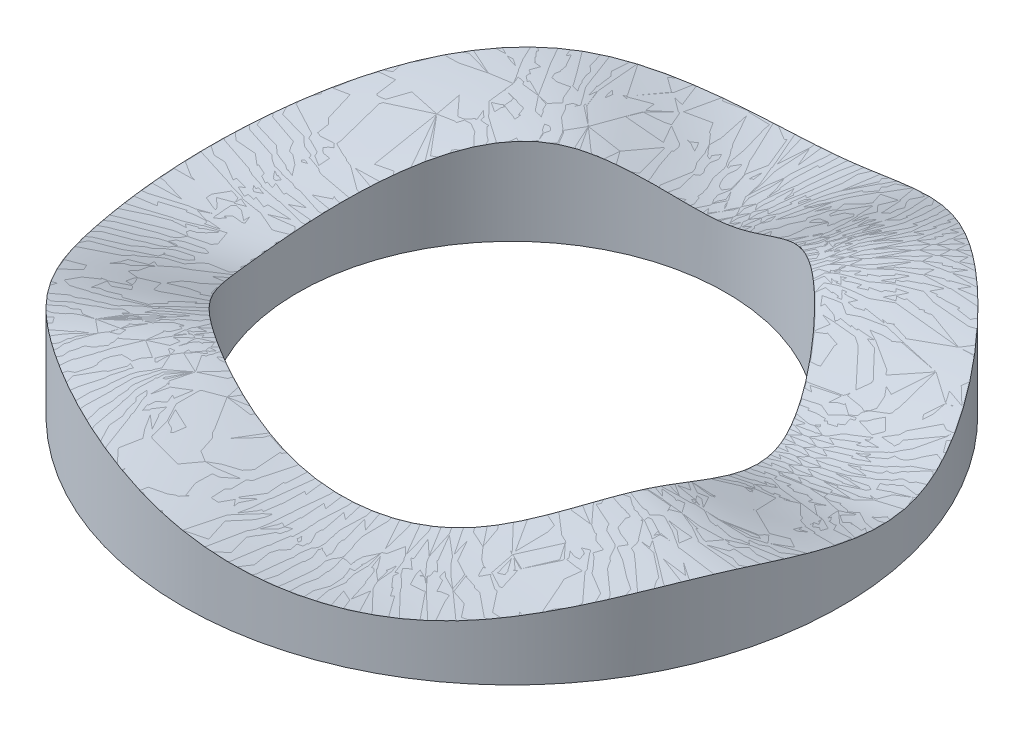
SolidWorks part; units mm, degrees
ref_plane "Ebene vorne" through (0, 0, 0) normal (0, 0, 1) x (1, 0, 0)
ref_plane "Ebene oben" through (0, 0, 0) normal (0, 1, 0) x (1, 0, 0)
ref_plane "Ebene rechts" through (0, 0, 0) normal (1, 0, 0) x (0, 0, -1)
sketch "Skizze1" plane through (0, 0, 0) normal (0, 1, 0) x (1, 0, 0)
  circle A0 centre (0, 0) radius 50
  circle A1 centre (0, 0) radius 32.5
  dimension "D1" = 100
  dimension "D2" = 65
extrude "Linear austragen1" add sketch "Skizze1" along normal blind 20
sketch "Skizze2" plane through (0, 20, 0) normal (0, 1, 0) x (1, 0, 0)
  line L0 (0, 0) -> (0, -50) construction
  line L1 (0, 0) -> (-29.3893, -40.4508) construction
  line L2 (0, 0) -> (-47.5528, -15.4508) construction
  line L3 (0, 0) -> (-47.5528, 15.4508) construction
  line L4 (0, 0) -> (-29.3893, 40.4508) construction
  line L5 (0, 0) -> (0, 50) construction
  line L6 (0, 0) -> (29.3893, 40.4508) construction
  line L7 (0, 0) -> (47.5528, 15.4508) construction
  line L8 (0, 0) -> (47.5528, -15.4508) construction
  line L9 (0, 0) -> (29.3893, -40.4508) construction
  circle A0 centre (0, 0) radius 50 construction
sketch3d "3D-Skizze1"
  spline S0 degree 3 poles (-31.4452, 18.6778, 43.0757) (-0.2043, 8.8385, 53.4326) (31.4376, 6.1421, 43.1658) (50.853, 14.6306, 16.5023) (50.5619, 1.1765, -17.1112) (31.5931, 22.8305, -42.9231) (0.2976, 3.7946, -53.4524) (-31.3557, 16.1997, -43.2221) (-50.7913, 9.3238, -16.6139) (-50.6782, 6.5436, 16.8503) (-31.4452, 18.6778, 43.0757) (-0.2043, 8.8385, 53.4326) (31.4376, 6.1421, 43.1658) knots -0.29941 -0.200615 -0.100028 0 0.09895 0.198157 0.297725 0.40057 0.501816 0.601383 0.70059 0.799385 0.899972 1 1.09895 1.198157 1.297725 only from (0, 10, 50) to (0, 10, 50)
  point P0 (0, 10, 50)
  point P1 (29.3893, 8, 40.4508)
  point P2 (47.5528, 11, 15.4508)
  point P5 (47.5528, 7, -15.4508)
  point P6 (29.3893, 16, -40.4508)
  point P7 (0, 9, -50)
  point P8 (-29.3893, 13, -40.4508)
  point P9 (-47.5528, 10, -15.4508)
  point P10 (-47.5528, 9, 15.4508)
  point P11 (-29.3893, 15, 40.4508)
  dimension "D1" = 10
  dimension "D2" = 15
  dimension "D3" = 8
  dimension "D4" = 11
  dimension "D5" = 7
  dimension "D6" = 16
  dimension "D7" = 9
  dimension "D8" = 13
  dimension "D9" = 10
  dimension "D10" = 9
sketch3d "3D-Skizze2"
  line L1 (0, 20, 0) -> (-29.3893, 20, -40.4508) construction
  line L2 (-19.103, 20, -26.2931) -> (-19.103, 0, -26.2931) construction
  line L3 (0, 20, -32.5) -> (0, 0, -32.5) construction
  line L4 (0, 20, 0) -> (0, 20, -50) construction
  line L6 (19.103, 20, -26.2931) -> (19.103, 0, -26.2931) construction
  line L7 (0, 20, 0) -> (29.3893, 20, -40.4508) construction
  line L10 (30.9093, 20, -10.0431) -> (30.9093, 0, -10.0431) construction
  line L11 (0, 20, 0) -> (47.5528, 20, -15.4508) construction
  line L12 (30.9093, 20, 10.0431) -> (30.9093, 0, 10.0431) construction
  line L13 (0, 20, 0) -> (47.5528, 20, 15.4508) construction
  line L14 (19.103, 20, 26.2931) -> (19.103, 0, 26.2931) construction
  line L15 (0, 20, 0) -> (29.3893, 20, 40.4508) construction
  line L16 (0, 20, 32.5) -> (0, 0, 32.5) construction
  line L17 (0, 20, 0) -> (0, 20, 50) construction
  line L18 (-19.103, 20, 26.2931) -> (-19.103, 0, 26.2931) construction
  line L19 (0, 20, 0) -> (-29.3893, 20, 40.4508) construction
  line L20 (-30.9093, 20, 10.0431) -> (-30.9093, 0, 10.0431) construction
  line L21 (0, 20, 0) -> (-47.5528, 20, 15.4508) construction
  line L22 (-30.9093, 20, -10.0431) -> (-30.9093, 0, -10.0431) construction
  line L23 (0, 20, 0) -> (-47.5528, 20, -15.4508) construction
  circle A0 centre (0, 20, 0) radius 32.5 construction
  circle A1 centre (0, 0, 0) radius 32.5 construction
  spline S0 degree 3 poles (-33.0182, 9.3339, -10.8954) (-20.352, 16.1576, -28.1137) (0.44, 3.8495, -34.7837) (20.6899, 22.8978, -27.6816) (32.6928, 1.2209, -11.6079) (33.1049, 14.5673, 10.7184) (20.4799, 6.1573, 28.0297) (-0.309, 8.8902, 34.7587) (-20.4853, 18.682, 27.8927) (-32.8515, 6.5963, 11.2501) (-33.0182, 9.3339, -10.8954) (-20.352, 16.1576, -28.1137) (0.44, 3.8495, -34.7837) knots -0.296796 -0.195436 -0.098197 0 0.099026 0.201875 0.308298 0.407324 0.505521 0.603121 0.703204 0.804564 0.901803 1 1.099026 1.201875 1.308298 only from (-19.103, 13, -26.2931) to (-19.103, 13, -26.2931)
  point P0 (-19.103, 15, 26.2931)
  point P1 (-30.9093, 9, 10.0431)
  point P2 (-30.9093, 10, -10.0431)
  point P3 (-19.103, 13, -26.2931)
  point P4 (0, 9, -32.5)
  point P5 (19.103, 16, -26.2931)
  point P9 (0, 10, 32.5)
  point P10 (19.103, 8, 26.2931)
  point P14 (0, 52.5, 0)
  point P17 (0, 32.5, 0)
  point P54 (30.9093, 11, 10.0431)
  point P55 (30.9093, 7, -10.0431)
  dimension "D1" = 16
  dimension "D2" = 9
  dimension "D3" = 13
  dimension "D4" = 10
  dimension "D5" = 9
  dimension "D6" = 15
  dimension "D7" = 7
  dimension "D8" = 11
  dimension "D9" = 8
  dimension "D10" = 10
sketch "Skizze3" plane through (0, 0, 0) normal (1, 0, 0) x (0, 0, -1)
  line L0 (-50, 10) -> (-32.5, 10) construction
surface "Oberflächenausfüllung1"
sketch "Skizze7" plane through (0, 20, 0) normal (0, 1, 0) x (1, 0, 0)
  circle A1 centre (0, 0) radius 50
  circle A2 centre (0, 0) radius 50
  circle A3 centre (0, 0) radius 32.5
  circle A4 centre (0, 0) radius 32.5 construction
  dimension "D1" = 0
extrude "Schnitt-Linear austragen1" cut sketch "Skizze7" against normal up to surface (9.999 mm away)
